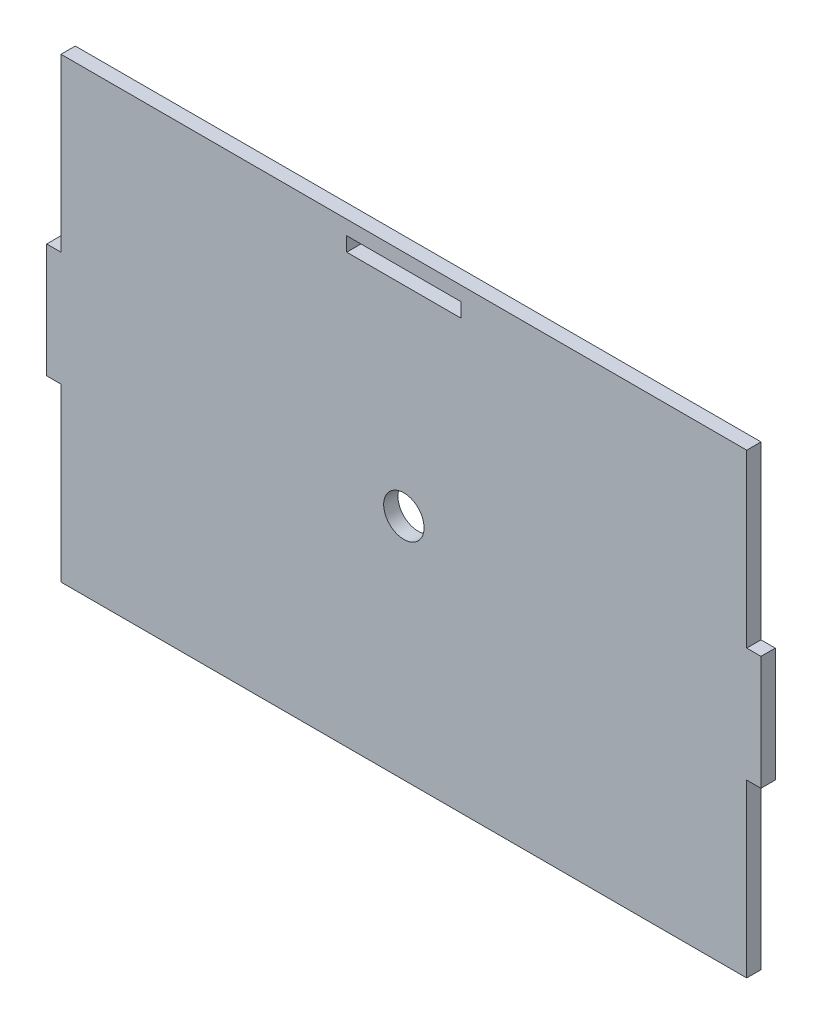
SolidWorks part; units mm, degrees
ref_plane "Front Plane" through (0, 0, 0) normal (0, 0, 1) x (1, 0, 0)
ref_plane "Top Plane" through (0, 0, 0) normal (0, 1, 0) x (1, 0, 0)
ref_plane "Right Plane" through (0, 0, 0) normal (1, 0, 0) x (0, 0, -1)
sketch "Sketch1" plane through (0, 0, 0) normal (0, 0, 1) x (1, 0, 0)
  line L0 (36.397, 36.6977) -> (87.197, 36.6977)
  line L1 (-65.203, 36.6977) -> (-14.403, 36.6977)
  line L2 (-65.203, 36.6977) -> (-65.203, -1.4023)
  line L3 (-65.203, -64.9023) -> (87.197, -64.9023)
  line L4 (87.197, 36.6977) -> (87.197, -1.4023)
  line L5 (-65.203, -1.4023) -> (-68.378, -1.4023)
  line L6 (87.197, -26.8023) -> (87.197, -64.9023)
  line L7 (-65.203, -26.8023) -> (-68.378, -26.8023)
  line L8 (-68.378, -1.4023) -> (-68.378, -26.8023)
  line L9 (-65.203, -26.8023) -> (-65.203, -64.9023)
  line L11 (-1.703, 33.5227) -> (23.697, 33.5227)
  line L12 (-1.703, 33.5227) -> (-1.703, 30.3477)
  line L13 (87.197, -1.4023) -> (90.372, -1.4023)
  line L14 (-14.403, 36.6977) -> (36.397, 36.6977)
  line L15 (87.197, -26.8023) -> (90.372, -26.8023)
  line L16 (90.372, -1.4023) -> (90.372, -26.8023)
  line L17 (-1.703, 30.3477) -> (23.697, 30.3477)
  line L18 (23.697, 33.5227) -> (23.697, 30.3477)
  circle A0 centre (10.997, -14.1023) radius 4.4901
  dimension "D14" = 8.9803
  dimension "D1" = 152.4
  dimension "D2" = 101.6
  dimension "D3" = 25.4
  dimension "D4" = 38.1
  dimension "D5" = 3.175
  dimension "D6" = 3.175
  dimension "D7" = 50.8
  dimension "D8" = 25.4
  dimension "D9" = 3.175
  dimension "D10" = 25.4
  dimension "D11" = 38.1
  dimension "D12" = 63.5
  dimension "D13" = 3.175
  dimension "D15" = 50.8
  dimension "D16" = 76.2
extrude "Boss-Extrude1" add sketch "Sketch1" along normal blind 3.175
